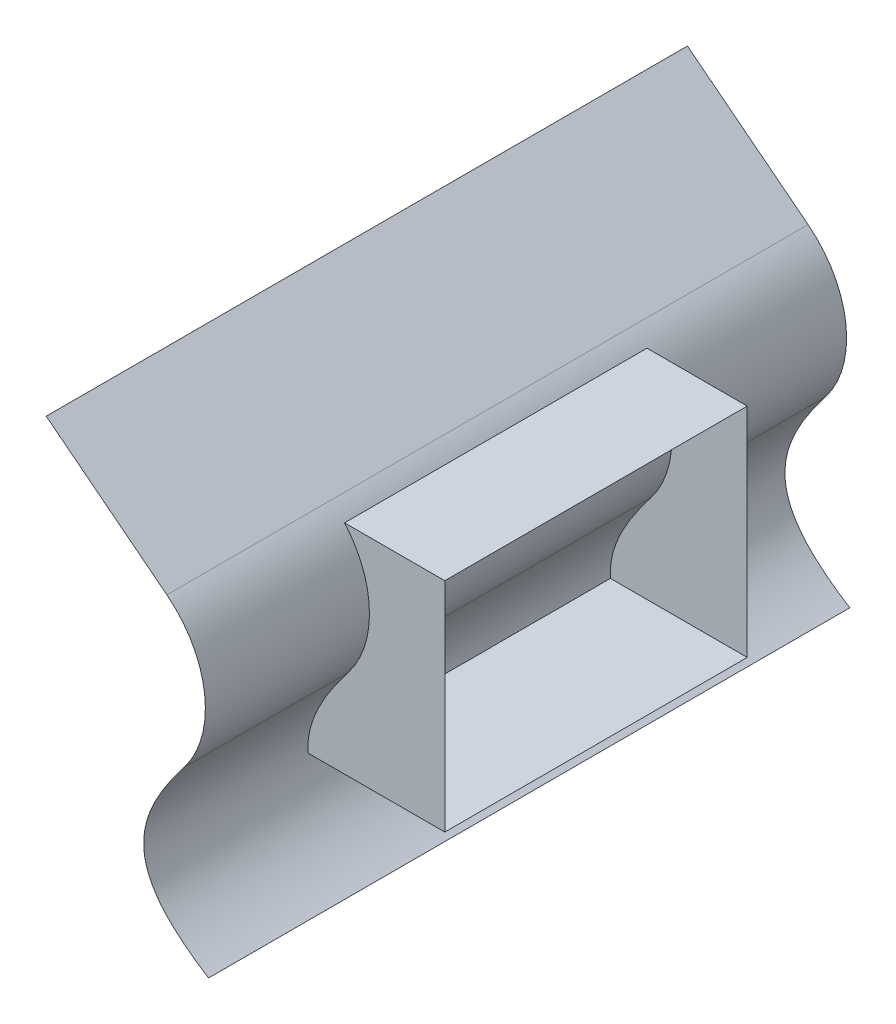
SolidWorks part; units mm, degrees
ref_plane "Front Plane" through (0, 0, 0) normal (0, 0, 1) x (1, 0, 0)
ref_plane "Top Plane" through (0, 0, 0) normal (0, 1, 0) x (1, 0, 0)
ref_plane "Right Plane" through (0, 0, 0) normal (1, 0, 0) x (0, 0, -1)
sketch "Sketch1" plane through (0, 0, 0) normal (0, 0, 1) x (1, 0, 0)
  line L0 (-31.6045, 66.2924) -> (10.7918, 33.1462)
  arc A0 (10.7918, 33.1462) -> (16.8464, -16.2997) centre (-10.9039, 5.3959) cw
  spline S0 degree 3 poles (16.8464, -16.2997) (-2.658, -41.2472) (-4.1149, -57.4923) (25.4378, -76.1207) knots 0 0 0 0 1 1 1 1
surface "Surface-Extrude1" sketch "Sketch1" parameters "D1"=115.316, "D2"=109.982
ref_plane "Plane1" through (50.8, 0, 0) normal (1, 0, 0) x (0, 0, -1)
sketch "Sketch2" plane through (50.8, 0, 0) normal (1, 0, 0) x (0, 0, -1)
  line L1 (-57.6766, 28.6283) -> (48.5858, 28.6283)
  line L2 (-57.6766, 28.6283) -> (-57.6766, -47.8484)
  line L3 (-57.6766, -47.8484) -> (48.5858, -47.8484)
  line L4 (48.5858, 28.6283) -> (48.5858, -47.8484)
surface "Surface-Extrude2" sketch "Sketch2"
